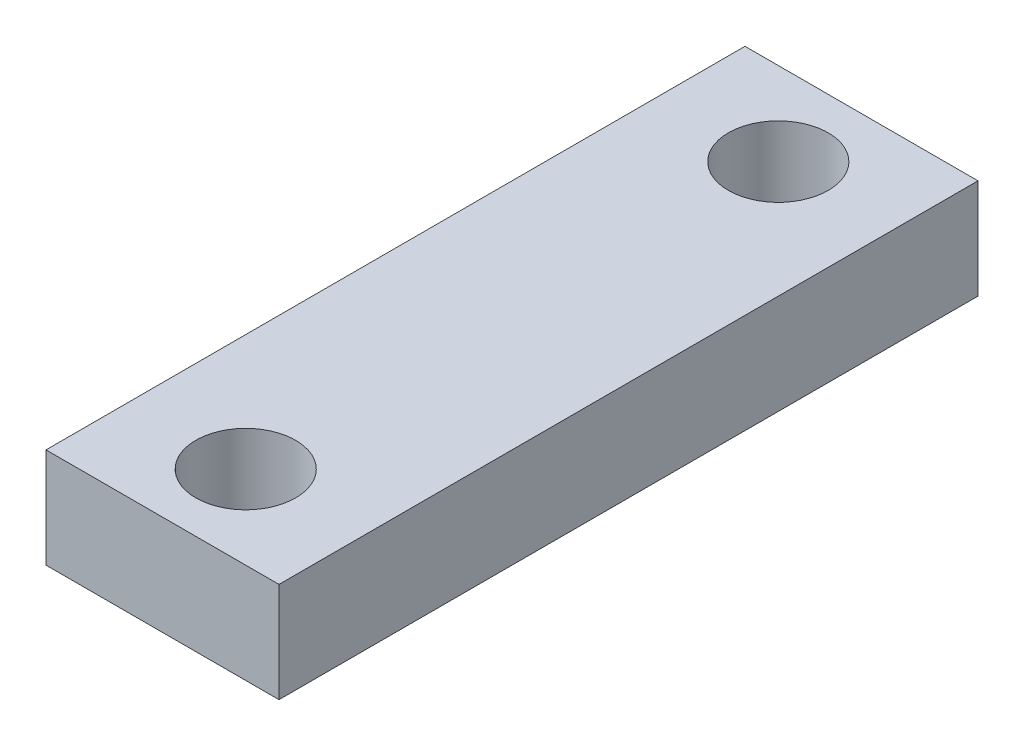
SolidWorks part; units mm, degrees
ref_plane "Front Plane" through (0, 0, 0) normal (0, 0, 1) x (1, 0, 0)
ref_plane "Top Plane" through (0, 0, 0) normal (0, 1, 0) x (1, 0, 0)
ref_plane "Right Plane" through (0, 0, 0) normal (1, 0, 0) x (0, 0, -1)
sketch "Sketch1" plane through (0, 0, 0) normal (0, 1, 0) x (1, 0, 0)
  line L0 (7, -21) -> (7, 21)
  line L1 (7, 21) -> (-7, 21)
  line L2 (-7, 21) -> (-7, -21)
  line L3 (-7, -21) -> (7, -21)
  circle A0 centre (0, 16) radius 3
  circle A1 centre (0, -16) radius 3
extrude "Boss-Extrude1" add sketch "Sketch1" along normal blind 6
